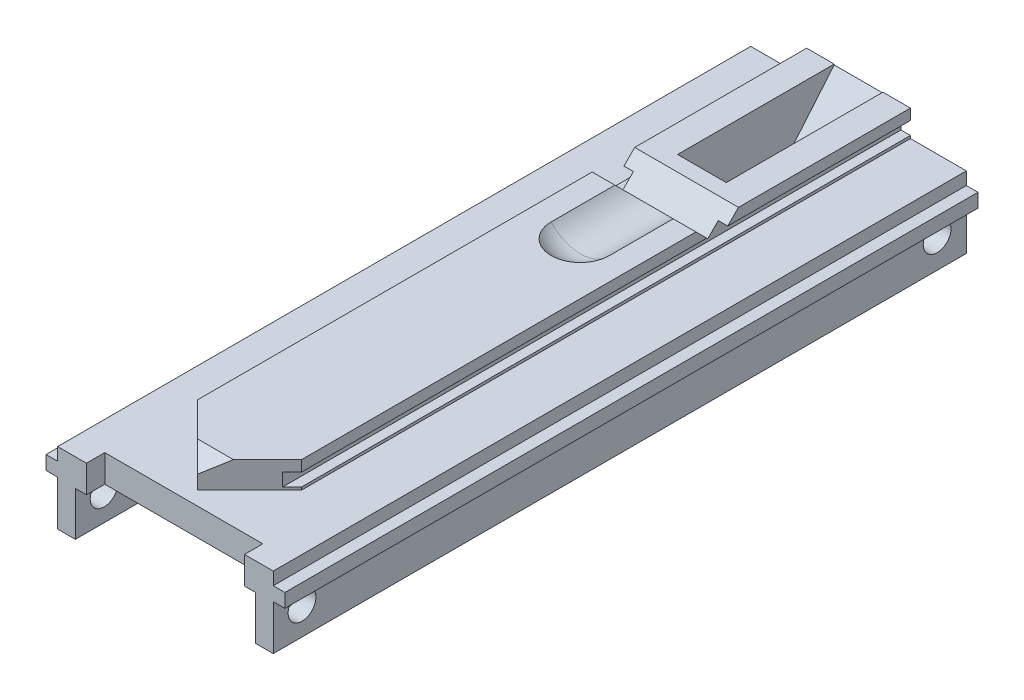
SolidWorks part; units mm, degrees
ref_plane "Спереди" through (0, 0, 0) normal (0, 0, 1) x (1, 0, 0)
ref_plane "Сверху" through (0, 0, 0) normal (0, 1, 0) x (1, 0, 0)
ref_plane "Справа" through (0, 0, 0) normal (1, 0, 0) x (0, 0, -1)
sketch "Эскиз1" plane through (0, 0, 0) normal (0, 0, 1) x (1, 0, 0)
  line L0 (0, -17.8793) -> (0, 27.9092) construction
  line L1 (-9.4742, 17.8816) -> (9.4742, 17.8816)
  line L2 (9.4742, 17.8816) -> (9.4742, 15.9156)
  line L3 (9.4742, 15.9156) -> (7.747, 15.9156)
  line L4 (7.747, 15.9156) -> (7.747, 13.5534)
  line L5 (7.747, 13.5534) -> (9.4742, 13.5534)
  line L6 (9.4742, 13.5534) -> (9.4742, 13.0556)
  line L7 (9.4742, 13.0556) -> (19.685, 13.0556)
  line L8 (19.685, 13.0556) -> (19.685, 10.734)
  line L9 (19.685, 10.734) -> (21.8059, 10.734)
  line L10 (21.8059, 10.734) -> (21.8059, 8.2194)
  line L11 (21.8059, 8.2194) -> (19.685, 8.2194)
  line L12 (19.685, 8.2194) -> (19.685, 0)
  line L13 (19.685, 0) -> (-19.685, 0)
  line L14 (-19.685, 8.2194) -> (-19.685, 0)
  line L15 (-21.8059, 8.2194) -> (-19.685, 8.2194)
  line L16 (-21.8059, 10.734) -> (-21.8059, 8.2194)
  line L17 (-19.685, 10.734) -> (-21.8059, 10.734)
  line L18 (-19.685, 13.0556) -> (-19.685, 10.734)
  line L19 (-9.4742, 13.0556) -> (-19.685, 13.0556)
  line L20 (-9.4742, 13.5534) -> (-9.4742, 13.0556)
  line L21 (-7.747, 13.5534) -> (-9.4742, 13.5534)
  line L22 (-7.747, 15.9156) -> (-7.747, 13.5534)
  line L23 (-9.4742, 15.9156) -> (-7.747, 15.9156)
  line L24 (-9.4742, 17.8816) -> (-9.4742, 15.9156)
  point P18 (0, 0)
  point P29 (0, 17.8816)
  dimension "D1" = 15.494
  dimension "D2" = 18.9484
  dimension "D3" = 39.37
  dimension "D4" = 43.6118
  dimension "D5" = 17.8816
  dimension "D6" = 13.0556
  dimension "D7" = 2.3622
  dimension "D8" = 2.5146
  dimension "D9" = 8.2194
  dimension "D10" = 5.1816
extrude "Бобышка-Вытянуть1" add sketch "Эскиз1" along normal blind 126.5428
sketch "Эскиз2" plane through (0, 17.8816, 0) normal (0, 1, 0) x (1, 0, 0)
  line L0 (9.4742, -126.5428) -> (-9.4742, -126.5428) construction
  line L1 (-14.4272, -126.5428) -> (14.4272, -126.5428)
  line L2 (-14.4272, -126.5428) -> (-14.4272, -123.19)
  line L3 (-14.4272, -123.19) -> (14.4272, -123.19)
  line L4 (14.4272, -126.5428) -> (14.4272, -123.19)
  line L5 (9.4742, 0) -> (-9.4742, 0) construction
  dimension "D1" = 28.8544
  dimension "D2" = 14.4272
  dimension "D3" = 123.19
extrude "Вырез-Вытянуть1" cut sketch "Эскиз2" against normal through all
sketch "Эскиз3" plane through (21.8059, 0, 0) normal (1, 0, 0) x (0, 0, -1)
  line L0 (-126.5428, 13.0556) -> (-120.65, 13.0556)
  line L1 (-120.65, 13.0556) -> (-120.65, 15.5956)
  line L2 (-120.65, 15.5956) -> (-117.3853, 17.8816)
  line L3 (-117.3853, 17.8816) -> (-126.5428, 17.8816)
  line L4 (-126.5428, 17.8816) -> (-126.5428, 13.0556)
  line L5 (-126.5428, 13.0556) -> (0, 13.0556) construction
  line L6 (-126.5428, 10.734) -> (-126.5428, 13.0556) construction
  line L7 (-123.19, 17.8816) -> (0, 17.8816) construction
  line L8 (0, 0) -> (0, 8.2194) construction
  line L9 (-126.5428, 0) -> (0, 0) construction
  line L10 (-39.1668, 17.8816) -> (-31.3944, 17.8816)
  line L11 (-31.3944, 17.8816) -> (-35.2806, 13.9954)
  line L12 (-35.2806, 13.9954) -> (-39.1668, 17.8816)
  line L13 (-35.2806, 13.9954) -> (-35.2806, 17.8816) construction
  circle A0 centre (-121.2901, 5.0419) radius 2.54
  circle A1 centre (-5.3391, 5.334) radius 2.54
  dimension "D8" = 5.08
  dimension "D1" = 2.286
  dimension "D2" = 35
  dimension "D3" = 120.65
  dimension "D4" = 5.0419
  dimension "D5" = 5.334
  dimension "D6" = 115.951
  dimension "D7" = 5.3391
  dimension "D9" = 35.2806
  dimension "D10" = 3.8862
extrude "Вырез-Вытянуть2" cut sketch "Эскиз3" against normal through all
sketch "Эскиз4" plane through (0, 0, 0) normal (1, 0, 0) x (0, 0, -1)
  line L0 (-61.1311, 22.6441) -> (-35.2806, 22.6441) construction
  line L1 (-57.9437, 22.6441) -> (-35.2806, 22.6441)
  line L2 (-35.2806, 22.6441) -> (-35.2806, 15.5003)
  line L3 (-35.2806, 15.5003) -> (-50.8, 15.5003)
  line L4 (-117.3853, 17.8816) -> (-39.1668, 17.8816) construction
  arc A0 (-50.8, 15.5003) -> (-57.9437, 22.6441) centre (-50.8, 22.6441) cw
  dimension "D2" = 7.1437
  dimension "D1" = 2.3813
  dimension "D3" = 50.8
revolve "Вырез-Повернуть1" cut sketch "Эскиз4" angle 360 about L0
sketch "Эскиз5" plane through (0, 0, 0) normal (1, 0, 0) x (0, 0, -1)
  line L0 (-6.1722, 0) -> (-126.5428, 0)
  line L1 (-126.5428, 0) -> (-126.5428, 8.0518)
  line L2 (-126.5428, 8.0518) -> (-30.6639, 8.0518)
  line L3 (-126.5428, 0) -> (0, 0) construction
  line L4 (-126.5428, 0) -> (-126.5428, 8.2194) construction
  line L5 (0, 0) -> (0, 8.2194) construction
  arc A0 (-6.1722, 0) -> (-30.6639, 8.0518) centre (-30.6639, -33.2232) ccw
  dimension "D2" = 41.275
  dimension "D1" = 8.0518
  dimension "D3" = 6.1722
extrude "Вырез-Вытянуть3" cut sketch "Эскиз5" against normal mid plane 32.893
sketch "Эскиз6" plane through (0, 0, 0) normal (1, 0, 0) x (0, 0, -1)
  line L0 (-28.5911, 17.8816) -> (-10.7095, 0)
  line L1 (-10.7095, 0) -> (-3.0354, 0)
  line L2 (-3.0354, 0) -> (-10.5013, 5.2277)
  line L3 (-10.5013, 5.2277) -> (0.1165, 17.8816)
  line L4 (0.1165, 17.8816) -> (-28.5911, 17.8816)
  line L5 (-31.3944, 17.8816) -> (0, 17.8816) construction
  line L6 (-126.5428, 0) -> (0, 0) construction
  line L7 (-5.3391, 5.334) -> (12.2007, 5.334) construction
  dimension "D1" = 45
  dimension "D2" = 50
  dimension "D3" = 35
  dimension "D4" = 3.8862
  dimension "D5" = 3.048
  dimension "D6" = 7.5692
extrude "Вырез-Вытянуть4" cut sketch "Эскиз6" against normal mid plane 8.89
sketch "Эскиз7" plane through (0, 17.8816, 0) normal (0, 1, 0) x (1, 0, 0)
  line L0 (0, 0) -> (0, -147.3619) construction
  line L1 (9.4742, -123.19) -> (9.4742, -111.1758)
  line L2 (9.4742, -111.1758) -> (0, -120.65)
  line L3 (0, -120.65) -> (-9.4742, -111.1758)
  line L4 (-9.4742, -117.3853) -> (-9.4742, -39.1668) construction
  line L5 (-9.4742, -111.1758) -> (-9.4742, -123.19)
  line L6 (-9.4742, -123.19) -> (9.4742, -123.19)
  line L7 (-14.4272, -123.19) -> (14.4272, -123.19) construction
  line L8 (9.4742, -117.3853) -> (9.4742, -39.1668) construction
  dimension "D1" = 90
  dimension "D2" = 2.54
extrude "Вырез-Вытянуть5" cut sketch "Эскиз7" against normal up to surface (4.826 mm away)
sketch "Эскиз8" plane through (0, 8.0518, 0) normal (0, -1, 0) x (1, 0, 0)
  line L0 (-16.4465, 30.6639) -> (16.4465, 30.6639) construction
  line L2 (6.223, 17.399) -> (6.223, 30.6639)
  line L3 (6.223, 30.6639) -> (-6.223, 30.6639)
  line L4 (-6.223, 17.399) -> (-6.223, 30.6639)
  arc A0 (-6.223, 17.399) -> (6.223, 17.399) centre (0, 17.399) ccw
  dimension "D1" = 12.446
  dimension "D2" = 17.399
extrude "Вырез-Вытянуть6" cut sketch "Эскиз8" along normal through all
fillet "Скругление1" radius 1.5875 1 edges at (0, 8.0518, 18.7613)
equation "\"D2@Эскиз2\"=\"D1@Эскиз2\"/2"
